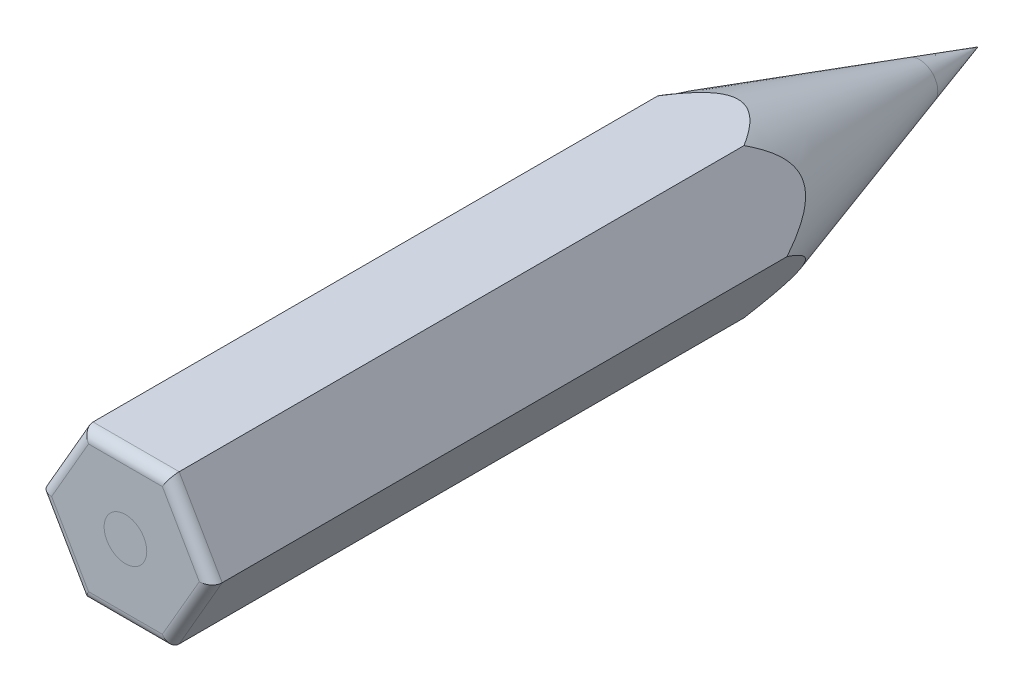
SolidWorks part; units mm, degrees
ref_plane "Plan de face" through (0, 0, 0) normal (0, 0, 1) x (1, 0, 0)
ref_plane "Plan de dessus" through (0, 0, 0) normal (0, 1, 0) x (1, 0, 0)
ref_plane "Plan de droite" through (0, 0, 0) normal (1, 0, 0) x (0, 0, -1)
sketch "Esquisse1" plane through (0, 0, 0) normal (0, 0, 1) x (1, 0, 0)
  line L0 (4.0415, 0) -> (0, 0) construction
  line L1 (4.0415, 0) -> (2.0207, 3.5)
  line L2 (2.0207, 3.5) -> (-2.0207, 3.5)
  line L3 (-2.0207, 3.5) -> (-4.0415, 0)
  line L4 (-4.0415, 0) -> (-2.0207, -3.5)
  line L5 (-2.0207, -3.5) -> (2.0207, -3.5)
  line L6 (2.0207, -3.5) -> (4.0415, 0)
  circle A0 centre (0, 0) radius 3.5 construction
  dimension "D1" = 7
extrude "Boss.-Extru.1" add sketch "Esquisse1" along normal blind 40
ref_plane "Plan1" through (0, 0, 0) normal (-0.866, 0.5, 0) x (0, 0, 1)
sketch "Esquisse3" plane through (0, 0, 0) normal (-0.866, 0.5, 0) x (0, 0, 1)
  line L0 (0, 0) -> (13, 4.0415)
  line L1 (0, 2.0207) -> (0, -2.0207) construction
  line L2 (40, 4.0415) -> (0, 4.0415) construction
  line L3 (13, 4.0415) -> (0, 4.0415) construction
  line L4 (0, 4.0415) -> (0, 0) construction
  line L5 (-6.497, 0) -> (52.2076, 0) construction
  line L7 (40, -4.0415) -> (0, -4.0415) construction
  dimension "D1" = 13
surface "Surface-Révolution1" sketch "Esquisse3" parameters "D1"=360
surface "Surface-Prolonger1" parameters "D1"=9
other "Enlèv. mat.-Surface1"
sketch "Esquisse4" plane through (0, 0, 40) normal (0, 0, 1) x (1, 0, 0)
  line L0 (-4.0415, 0) -> (4.0415, 0) construction
  circle A0 centre (0, 0) radius 1
  dimension "D1" = 2
sketch "Esquisse5" plane through (0, 0, 0) normal (-0.866, 0.5, 0) x (0, 0, 1)
  line L0 (2.7382, 1.9622) -> (2.7382, -1.8796)
fillet "Congé1" radius 0.5 6 edges at (0, -3.5, 40) (-3.0311, -1.75, 40) (-3.0311, 1.75, 40) (0, 3.5, 40) (3.0311, 1.75, 40) (3.0311, -1.75, 40)
